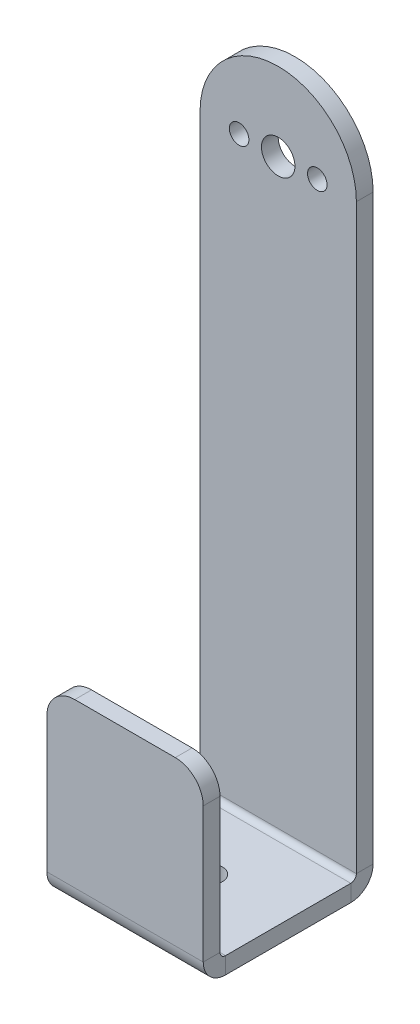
SolidWorks part; units mm, degrees
ref_plane "Front Plane" through (0, 0, 0) normal (0, 0, 1) x (1, 0, 0)
ref_plane "Top Plane" through (0, 0, 0) normal (0, 1, 0) x (1, 0, 0)
ref_plane "Right Plane" through (0, 0, 0) normal (1, 0, 0) x (0, 0, -1)
sketch "Sketch1" plane through (0, 0, 0) normal (0, 0, 1) x (1, 0, 0)
  line L0 (14, 159) -> (14, 0) construction
  line L1 (0, 0) -> (28, 0)
  line L2 (0, 0) -> (0, 159)
  line L3 (0, 159) -> (28, 159) construction
  line L4 (28, 0) -> (28, 159)
  arc A0 (28, 159) -> (0, 159) centre (14, 159) ccw
  circle A1 centre (14, 42) radius 2.25
  circle A2 centre (14, 159) radius 3
  circle A3 centre (21, 159) radius 1.75
  circle A4 centre (7, 159) radius 1.75
  dimension "D2" = 159
  dimension "D3" = 42
  dimension "D4" = 4.5
  dimension "D5" = 6
  dimension "D6" = 3.5
  dimension "D7" = 3.5
  dimension "D8" = 7
  dimension "D9" = 14
  dimension "D1" = 28
sheet metal parameters "Sheet-Metal1" thickness 3 parameters "D1"=1
base flange "Base-Flange1" sketch "Sketch1" thickness 3 reverse thickness direction yes parameters "D1"=1
sketch "Sketch3" plane through (0, 0, 3) normal (0, 0, 1) x (1, 0, 0)
  line L0 (0, 54) -> (28, 54)
  line L1 (0, 159) -> (0, 0) construction
  line L2 (28, 0) -> (28, 159) construction
  line L3 (28, 30) -> (0, 30)
  line L4 (0, 0) -> (28, 0) construction
  dimension "D1" = 30
  dimension "D2" = 24
sketched bend "Sketched Bend1" parameters "D1"=1
bend "SketchBend1" bend radius 1 bend angle 90 parameters "D5"=1
bend "SketchBend2" bend radius 0 bend angle 90 parameters "D5"=2
fillet "Fillet1" radius 5 2 edges at (28, 84, 28.9292) (0, 84, 28.9292)
flat pattern "Flat-Pattern1"
sketch "Bend-Lines1" plane through (0, 0, 0) normal (0, 1, 0) x (-1, 0, 0)
bend of the flat pattern "Flatten-<SketchBend1>1"
bend of the flat pattern "Flatten-<SketchBend2>1"
